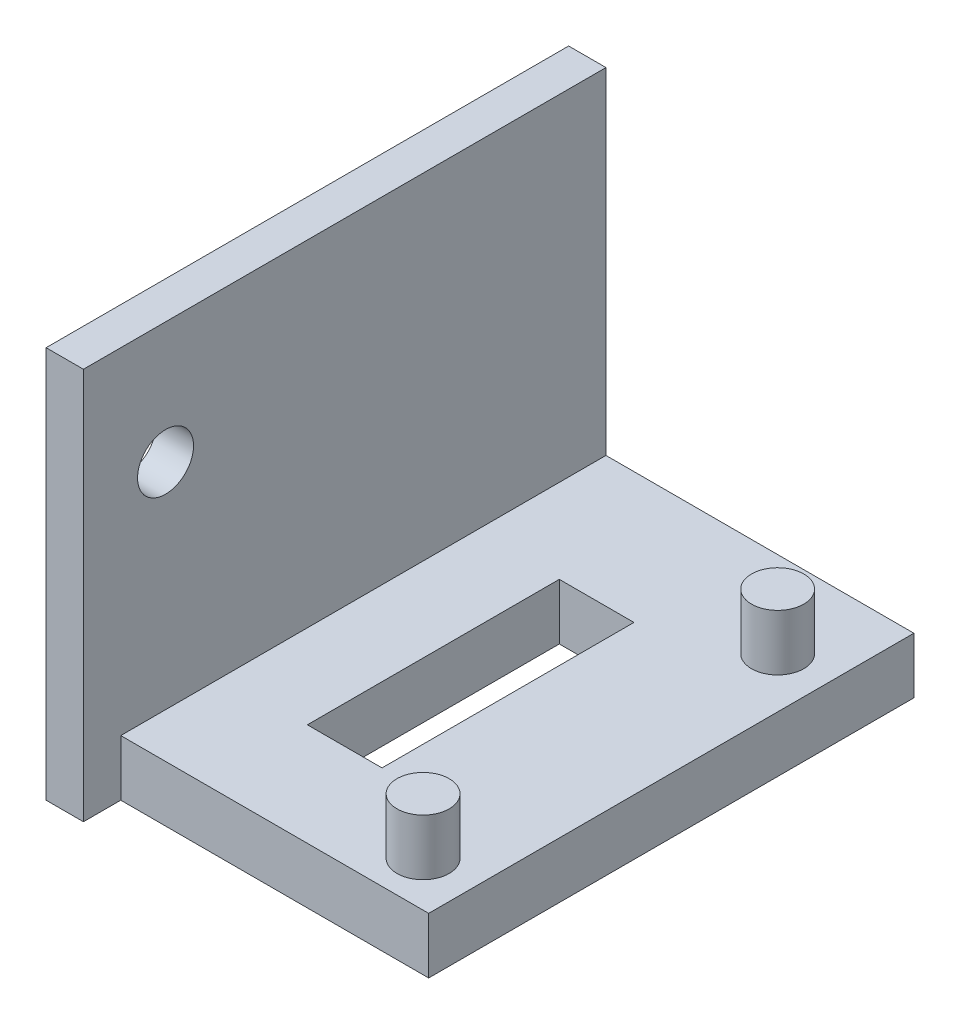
SolidWorks part; units mm, degrees
ref_plane "前视基准面" through (0, 0, 0) normal (0, 0, 1) x (1, 0, 0)
ref_plane "上视基准面" through (0, 0, 0) normal (0, 1, 0) x (1, 0, 0)
ref_plane "右视基准面" through (0, 0, 0) normal (1, 0, 0) x (0, 0, -1)
sketch "草图5" plane through (0, 0, 0) normal (0, 1, 0) x (1, 0, 0)
  line L1 (-8.25, 13) -> (8.25, 13)
  line L2 (-8.25, 13) -> (-8.25, -13)
  line L3 (-8.25, -13) -> (8.25, -13)
  line L4 (8.25, 13) -> (8.25, -13)
  line L5 (-8.25, 13) -> (8.25, -13) construction
  line L6 (-8.25, -13) -> (8.25, 13) construction
  line L7 (-3.75, 6) -> (0.25, 6)
  line L8 (-3.75, 6) -> (-3.75, -7.5)
  line L9 (-3.75, -7.5) -> (0.25, -7.5)
  line L10 (0.25, 6) -> (0.25, -7.5)
  line L11 (-3.75, 6) -> (0.25, -7.5) construction
  line L12 (-3.75, -7.5) -> (0.25, 6) construction
  point P0 (0, 0)
  point P6 (-1.75, -0.75)
  point P17 (6.7864, -10.6938)
  point P18 (5.8178, 1.121)
  dimension "D1" = 16.5
  dimension "D2" = 26
  dimension "D3" = 8
  dimension "D4" = 12
  dimension "D5" = 5.5
  dimension "D6" = 19
extrude "凸台-拉伸1" add sketch "草图5" against normal blind 3
sketch "草图7" plane through (0, 0, 0) normal (0, 1, 0) x (1, 0, 0)
  line L0 (-8.25, -13) -> (8.25, -13) construction
  line L1 (-8.25, -13) -> (8.25, -13) construction
  line L2 (8.25, -13) -> (8.25, 13) construction
  line L3 (8.25, -13) -> (8.25, 13) construction
  circle A0 centre (5.55, 8.4) radius 1.4
  circle A1 centre (5.55, -10.6) radius 1.4
  point P13 (8.25, -7.1909)
  point P14 (7.6677, -7.5882)
  point P15 (5.612, -9.9634)
  dimension "D1" = 2.8
  dimension "D2" = 2.8
  dimension "D3" = 2.4
  dimension "D4" = 2.7
  dimension "D5" = 19
extrude "凸台-拉伸2" add sketch "草图7" along normal blind 3
sketch "草图6" plane through (0, 0, 0) normal (0, 1, 0) x (1, 0, 0)
  line L3 (-10.25, 13) -> (-8.25, 13)
  line L4 (-10.25, 13) -> (-10.25, -15)
  line L5 (-10.25, -15) -> (-8.25, -15)
  line L6 (-8.25, 13) -> (-8.25, -15)
  circle A0 centre (5.55, -10.6) radius 1.4 construction
  circle A1 centre (5.55, -10.6) radius 1.4 construction
  dimension "D1" = 15
  dimension "D2" = 2
  dimension "D3" = 10.25
  dimension "D4" = 28
extrude "凸台-拉伸3" add sketch "草图6" along normal blind 18 and the other way blind 3
sketch "草图8" plane through (0, 0, 0) normal (1, 0, 0) x (0, 0, -1)
  line L0 (-15, -3) -> (-15, 18) construction
  line L1 (-15, -3) -> (-15, 18) construction
  circle A0 centre (-10.6, 11.5) radius 1.5
  dimension "D1" = 3
  dimension "D2" = 4.4
  dimension "D3" = 11.5
extrude "切除-拉伸1" cut sketch "草图8" against normal blind 18
